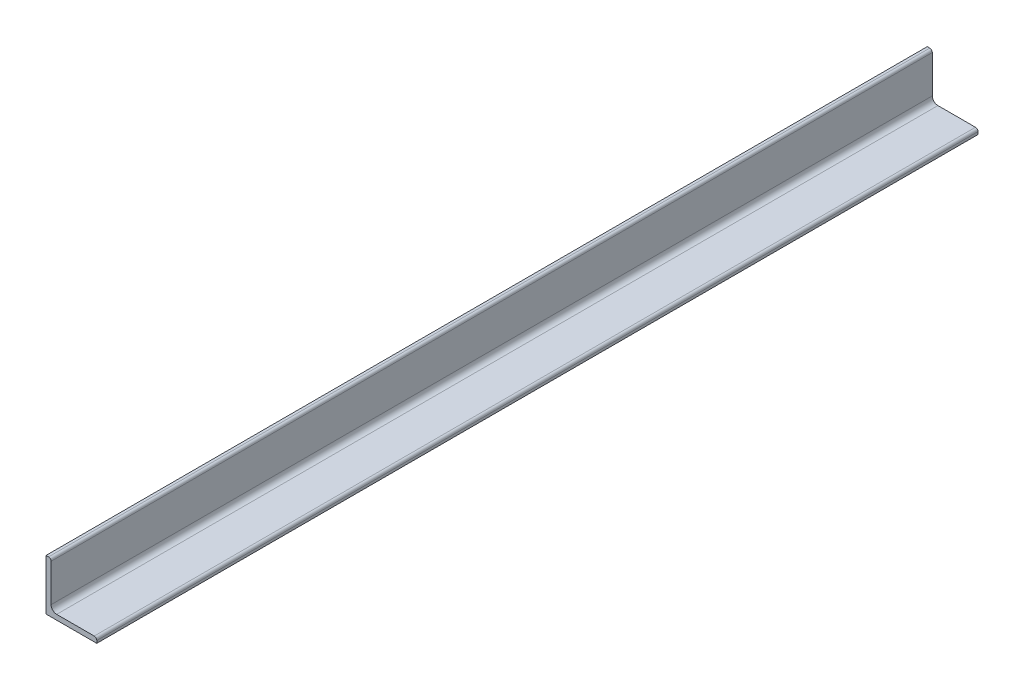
SolidWorks part; units mm, degrees
ref_plane "前视基准面" through (0, 0, 0) normal (0, 0, 1) x (1, 0, 0)
ref_plane "上视基准面" through (0, 0, 0) normal (0, 1, 0) x (1, 0, 0)
ref_plane "右视基准面" through (0, 0, 0) normal (1, 0, 0) x (0, 0, -1)
sketch "草图1" plane through (0, 0, 0) normal (0, 0, 1) x (1, 0, 0)
  line L0 (0, 50) -> (0, 0)
  line L1 (0, 0) -> (50, 0)
  line L2 (50, 0) -> (50, 2.5)
  line L3 (47.5, 5) -> (10.5, 5)
  line L4 (5, 10.5) -> (5, 47.5)
  line L5 (2.5, 50) -> (0, 50)
  arc A0 (10.5, 5) -> (5, 10.5) centre (10.5, 10.5) cw
  arc A1 (5, 47.5) -> (2.5, 50) centre (2.5, 47.5) ccw
  arc A2 (50, 2.5) -> (47.5, 5) centre (47.5, 2.5) ccw
  point P11 (5, 50)
  point P14 (50, 5)
  dimension "D5" = 5.5
  dimension "D6" = 2.5
  dimension "D1" = 5
  dimension "D2" = 5
  dimension "D3" = 50
  dimension "D4" = 50
extrude "拉伸1" add sketch "草图1" along normal blind 868
